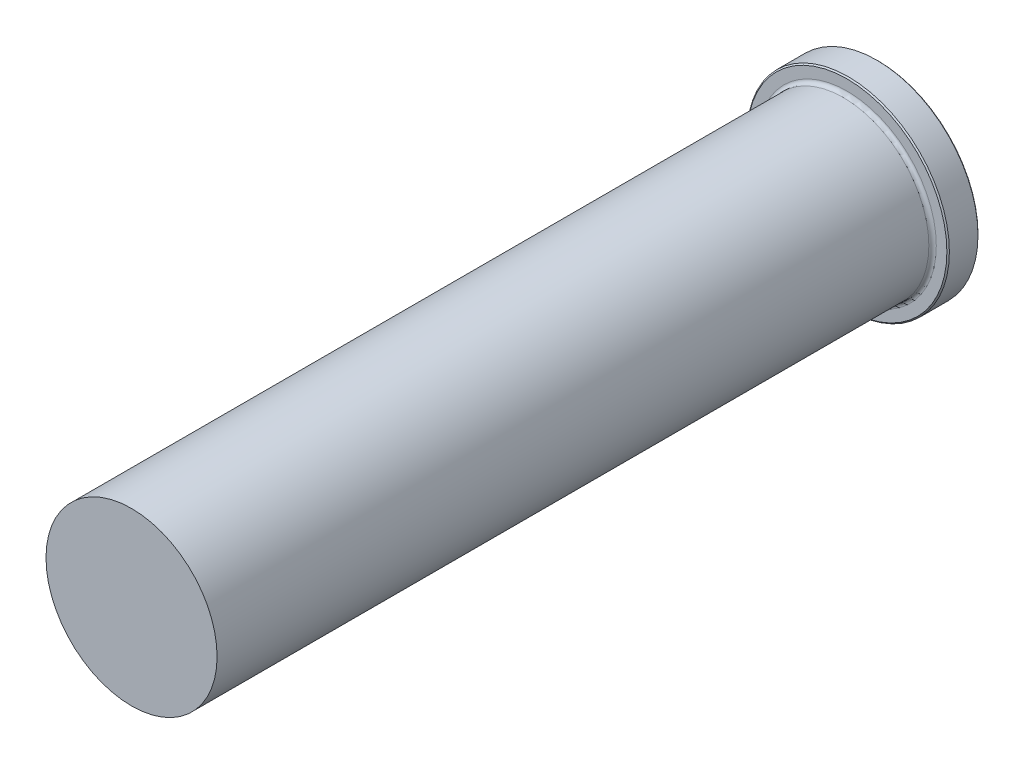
SolidWorks part; units mm, degrees
ref_plane "Front Plane" through (0, 0, 0) normal (0, 0, 1) x (1, 0, 0)
ref_plane "Top Plane" through (0, 0, 0) normal (0, 1, 0) x (1, 0, 0)
ref_plane "Right Plane" through (0, 0, 0) normal (1, 0, 0) x (0, 0, -1)
sketch "Sketch1" plane through (0, 0, 0) normal (1, 0, 0) x (0, 0, -1)
  line L0 (0, 0) -> (-156.8087, 0) construction
  line L1 (0, 0) -> (0, 20.6375)
  line L2 (0, 20.6375) -> (-6.35, 20.6375)
  line L3 (-6.35, 20.6375) -> (-6.35, 17.4625)
  line L4 (-6.35, 17.4625) -> (-152.4, 17.4625)
  line L5 (-152.4, 17.4625) -> (-152.4, 0)
  line L6 (-152.4, 0) -> (0, 0)
  dimension "D1" = 41.275
  dimension "D2" = 34.925
  dimension "D3" = 6.35
  dimension "D4" = 152.4
revolve "Revolve1" add sketch "Sketch1" angle 360 about L0
fillet "Fillet1" radius 0.762 1 edges at (-17.4625, 0, 6.35)
chamfer "Chamfer1" distance 0.254 angle 45 2 edges at (-20.6375, 0, 0) (-20.6375, 0, 6.35)
